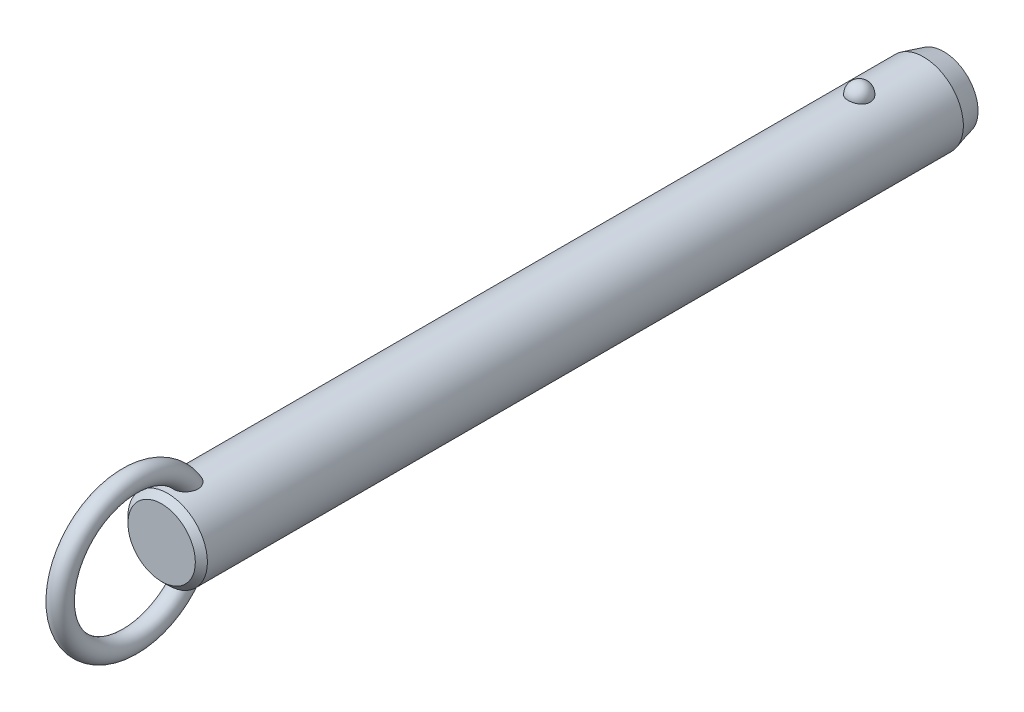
SolidWorks part; units mm, degrees
ref_plane "Front Plane" through (0, 0, 0) normal (0, 0, 1) x (1, 0, 0)
ref_plane "Top Plane" through (0, 0, 0) normal (0, 1, 0) x (1, 0, 0)
ref_plane "Right Plane" through (0, 0, 0) normal (1, 0, 0) x (0, 0, -1)
sketch "Sketch2" plane through (0, 0, 0) normal (0, 0, 1) x (1, 0, 0)
  circle A0 centre (0, 0) radius 7.9
  point P3 (0, 7.9)
  dimension "D1" = 15.8
extrude "Boss-Extrude1" add sketch "Sketch2" along normal blind 127
sketch "Sketch3" plane through (0, 0, 0) normal (0, 0, -1) x (-1, 0, 0)
  circle A0 centre (0, 0) radius 7.9
  dimension "D1" = 15.8
extrude "Boss-Extrude2" add sketch "Sketch3" along normal blind 19
chamfer "Chamfer1" distance 4 angle 15 1 edges at (-7.9, 0, -19)
sketch "Sketch12" plane through (0, 0, 0) normal (1, 0, 0) x (0, 0, -1)
  line L0 (-127, 7.9) -> (-127, -7.9) construction
  point P0 (-127, 0)
sketch "Sketch13" plane through (0, 0, 0) normal (1, 0, 0) x (0, 0, -1)
  circle A0 centre (-142.85, 0) radius 15.85
  point P2 (-127, 0)
  dimension "D1" = 31.7
sketch "Sketch14" plane through (0, 0, 0) normal (0, 1, 0) x (1, 0, 0)
  circle A0 centre (0, -129) radius 2
  point P2 (0, -127)
  dimension "D1" = 4
sweep "Sweep1" add profiles "Sketch14" path "Sketch13"
sketch "Sketch15" plane through (0, 0, 127) normal (0, 0, 1) x (1, 0, 0)
  circle A0 centre (0, 0) radius 7.9
  dimension "D1" = 15.8
extrude "Boss-Extrude3" add sketch "Sketch15" along normal blind 9.52
chamfer "Chamfer2" distance 1.2 angle 45 1 edges at (7.9, 0, 136.52)
sketch "Sketch18" plane through (0, 0, 0) normal (1, 0, 0) x (0, 0, -1)
  line L0 (15, 7.9) -> (-129.1091, 7.9) construction
  line L1 (2.2, 10.1) -> (2.2, 5.7)
  line L2 (-129.1091, -7.9) -> (15, -7.9) construction
  arc A0 (2.2, 10.1) -> (2.2, 5.7) centre (2.2, 7.9) ccw
  point P4 (0, 7.9)
  dimension "D1" = 18
revolve "Revolve1" add sketch "Sketch18" angle 360 about L1
